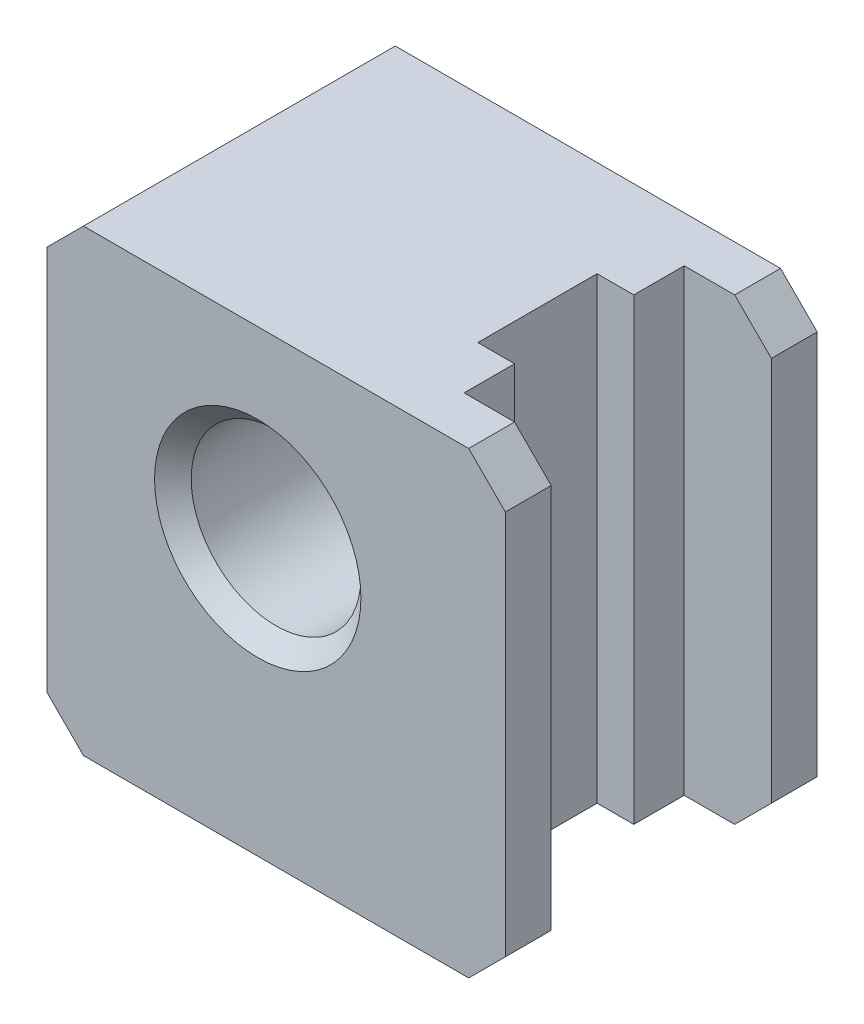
SolidWorks part; units mm, degrees
ref_plane "Plan de face" through (0, 0, 0) normal (0, 0, 1) x (1, 0, 0)
ref_plane "Plan de dessus" through (0, 0, 0) normal (0, 1, 0) x (1, 0, 0)
ref_plane "Plan de droite" through (0, 0, 0) normal (1, 0, 0) x (0, 0, -1)
sketch "Esquisse1" plane through (0, 0, 0) normal (0, 0, 1) x (1, 0, 0)
  line L0 (25, 25) -> (-25, -25) construction
  line L1 (-25, 25) -> (25, 25)
  line L2 (-25, 25) -> (-25, -25)
  line L3 (-25, -25) -> (25, -25)
  line L4 (25, 25) -> (25, -25)
  dimension "D1" = 50
  dimension "D2" = 50
extrude "Extrusion1" add sketch "Esquisse1" along normal mid plane 34
hole_wizard "Diamètre du perçage Ø18.5 (18.5)2" positions "Esquisse3" profile "Esquisse4" hole size "Ø18.5" standard "ISO"
sketch "Esquisse3" plane through (0, 0, 17) normal (0, 0, 1) x (1, 0, 0)
  line L0 (25, 25) -> (-25, 25) construction
  line L2 (25, -25) -> (25, 25) construction
  point P0 (-2, 5)
  dimension "D1" = 20
  dimension "D2" = 27
sketch "Esquisse4" plane through (-2, 5, 17) normal (1, 0, 0) x (0, -1, 0)
  line L0 (0, 0) -> (0, 34)
  line L1 (0, 34) -> (9.25, 34)
  line L2 (9.25, 34) -> (9.25, 0)
  line L5 (9.25, 0) -> (0, 0)
  line L11 (0, -6.35) -> (0, 107.95) construction
  dimension "Diamètre du perçage jusqu'au prochain" = 18.5
  dimension "Profondeur du perçage jusqu'au prochain" = 34
chamfer "Chanfrein1" distance 2 angle 45 2 edges at (7.25, 5, 17) (7.25, 5, -17)
chamfer "Chanfrein2" distance 4 angle 45 4 edges at (25, -25, 0) (-25, -25, 0) (-25, 25, 0) (25, 25, 0)
sketch "Esquisse5" plane through (25, 0, 0) normal (1, 0, 0) x (0, 0, -1)
  line L0 (-17, 25) -> (17, 25) construction
  line L1 (-12, 25) -> (12, 25)
  line L2 (-12, 25) -> (-12, -25)
  line L3 (-12, -25) -> (12, -25)
  line L4 (12, 25) -> (12, -25)
  line L5 (17, -25) -> (-17, -25) construction
  line L6 (0, 0) -> (0, -16.3694) construction
  dimension "D1" = 24
extrude "Extrusion2" cut sketch "Esquisse5" against normal blind 9.5
sketch "Esquisse6" plane through (15.5, 0, 0) normal (1, 0, 0) x (0, 0, -1)
  line L0 (12, 25) -> (-12, 25) construction
  line L1 (-6.5, 25) -> (6.5, 25)
  line L2 (-6.5, 25) -> (-6.5, -25)
  line L3 (-6.5, -25) -> (6.5, -25)
  line L4 (6.5, 25) -> (6.5, -25)
  line L5 (-12, -25) -> (12, -25) construction
  line L6 (0, 0) -> (0, -8.7882) construction
  dimension "D1" = 13
extrude "Extrusion3" cut sketch "Esquisse6" against normal blind 4
thread "Filetage1" pitch 1.5 start angle 0, offset 5, length 45, pitch 1.5, diameter 18.5
ref_plane "Plan1" through (-11.25, 5, 20) normal (0, -1, 0) x (-1, 0, 0)
sketch "Profil de filetage1" plane through (-11.25, 5, 20) normal (0, -1, 0) x (-1, 0, 0)
  line L0 (0, 0) -> (0, 1.5) construction
  line L1 (0, 0) -> (0.8119, 0.4687)
  line L2 (0.8119, 0.4687) -> (0.8119, 0.6562)
  line L3 (0.8119, 0.6562) -> (0, 1.125)
  line L4 (0.8119, 0.5625) -> (0, 0.5625) construction
  line L11 (0, 0) -> (0, 1.125)
  point P2 (0, 0)
  dimension "Pitch" = 1.5
  dimension "Profile_Angle" = 60
  dimension "Profile_Land" = 0.1875
  dimension "Profile_Height" = 0.8119
